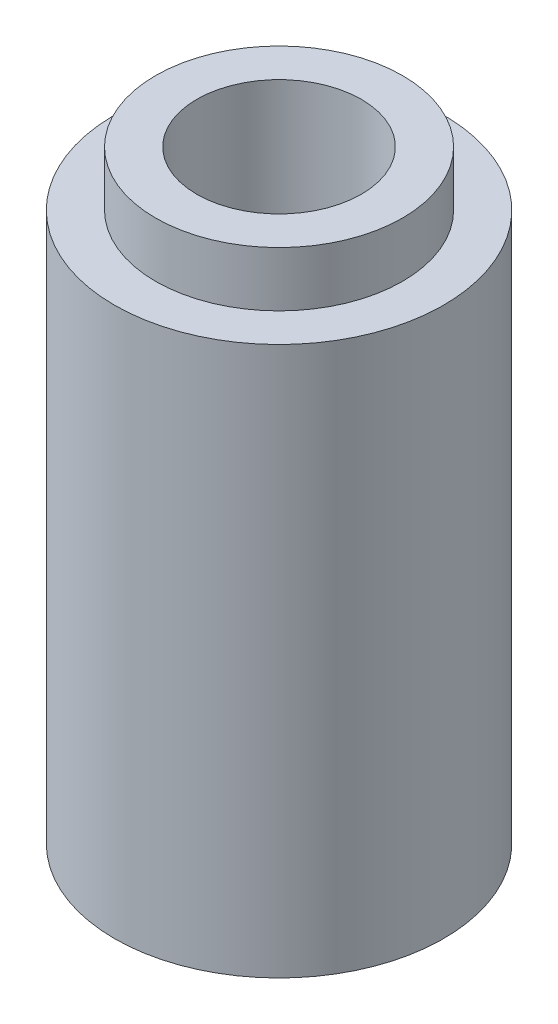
SolidWorks part; units mm, degrees
ref_plane "Спереди" through (0, 0, 0) normal (0, 0, 1) x (1, 0, 0)
ref_plane "Сверху" through (0, 0, 0) normal (0, 1, 0) x (1, 0, 0)
ref_plane "Справа" through (0, 0, 0) normal (1, 0, 0) x (0, 0, -1)
sketch "Эскиз1" plane through (0, 0, 0) normal (0, 1, 0) x (1, 0, 0)
  circle A0 centre (0, 0) radius 3
extrude "Бобышка-Вытянуть1" add sketch "Эскиз1" along normal blind 10
sketch "Эскиз2" plane through (0, 10, 0) normal (0, 1, 0) x (1, 0, 0)
  circle A0 centre (0, 0) radius 2.25
extrude "Бобышка-Вытянуть2" add sketch "Эскиз2" along normal blind 1
sketch "Эскиз3" plane through (0, 0, 0) normal (0, -1, 0) x (1, 0, 0)
  circle A0 centre (0, 0) radius 1.5
extrude "Вырез-Вытянуть1" cut sketch "Эскиз3" against normal up to surface (11 mm away)
